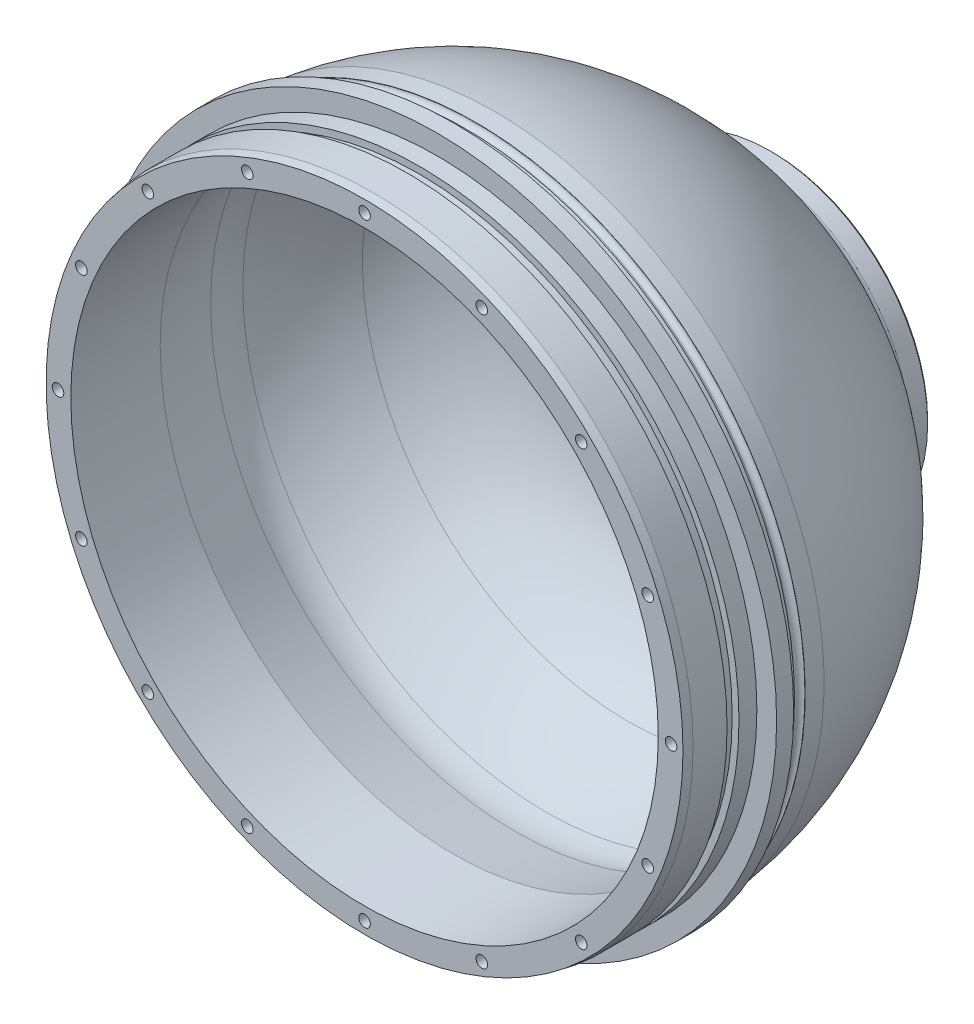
SolidWorks part; units mm, degrees
ref_plane "Front Plane" through (0, 0, 0) normal (0, 0, 1) x (1, 0, 0)
ref_plane "Top Plane" through (0, 0, 0) normal (0, 1, 0) x (1, 0, 0)
ref_plane "Right Plane" through (0, 0, 0) normal (1, 0, 0) x (0, 0, -1)
sketch "Sketch1" plane through (0, 0, 0) normal (1, 0, 0) x (0, 0, -1)
  line L0 (0, 0) -> (0, -87.63) construction
  line L1 (0, -87.63) -> (0, -101.346)
  line L2 (0, -87.63) -> (26.67, -87.63)
  line L3 (0, 0) -> (164.6305, 0) construction
  line L4 (0, -101.346) -> (26.67, -101.346)
  line L5 (26.67, -101.346) -> (26.67, -98.298)
  line L6 (26.67, -98.298) -> (38.7801, -98.298)
  line L8 (121.7669, 0) -> (121.7669, -46.99)
  line L9 (121.7669, 0) -> (101.4469, 0)
  line L10 (26.67, -87.63) -> (49.53, -91.9045)
  line L11 (101.4469, 0) -> (101.4469, -57.9788)
  line L12 (121.7669, -46.99) -> (113.7225, -46.99)
  arc A1 (49.53, -91.9045) -> (101.4469, -57.9788) centre (26.5169, 0) ccw
  arc A2 (38.7801, -98.298) -> (113.7225, -46.99) centre (26.5169, 0) ccw
  dimension "D6" = 99.06
  dimension "D7" = 94.742
  dimension "D1" = 87.63
  dimension "D2" = 101.346
  dimension "D3" = 26.67
  dimension "D4" = 26.67
  dimension "D5" = 3.048
  dimension "D8" = 46.99
  dimension "D9" = 20.32
  dimension "D10" = 22.86
  dimension "D11" = 12.1101
  dimension "D12" = 95.0969
revolve "hemi" add sketch "Sketch1" angle 360 about L3
sketch "Sketch2" plane through (0, 0, 0) normal (0, 0, 1) x (1, 0, 0)
  circle A0 centre (0, 0) radius 95.4532
  dimension "D1" = 190.9064
extrude "oring_plug" cut sketch "Sketch2" against normal blind 21.59 flip side to cut
ref_plane "oring_plane" through (0, 0, -12.7) normal (0, 0, 1) x (1, 0, 0)
sketch "Sketch3" plane through (0, 0, -12.7) normal (0, 0, 1) x (1, 0, 0)
  circle A0 centre (0, 0) radius 93.4212
  dimension "D1" = 186.8424
extrude "oring_groove" cut sketch "Sketch3" against normal blind 3.556 flip side to cut
chamfer "lead_in_chamfer" distance 2.54 distance2 0.4572 1 edges at (95.4532, 0, 0)
fillet "inside_blkhd_fillet" radius 50.8 1 edges at (57.9788, 0, -101.4469)
fillet "inside_flange_fillet" radius 19.05 1 edges at (91.9045, 0, -49.53)
ref_plane "ortman_plane" through (0, 0, -29.972) normal (0, 0, -1) x (-1, 0, 0)
sketch "Sketch4" plane through (0, 0, -29.972) normal (0, 0, -1) x (-1, 0, 0)
  circle A0 centre (0, 0) radius 96.647
  dimension "D1" = 193.294
extrude "ortman_groove" cut sketch "Sketch4" along normal blind 3.175 flip side to cut
fillet "ortman_fillet" radius 1.5875 2 edges at (-96.647, 0, -29.972) (-96.647, 0, -33.147)
sketch "Sketch5" plane through (0, 0, 0) normal (0, 0, 1) x (1, 0, 0)
  circle A0 centre (0, 0) radius 91.44 construction
  circle A1 centre (0, 91.44) radius 1.7272
  circle A2 centre (34.9926, 84.4795) radius 1.7272
  circle A3 centre (64.6578, 64.6578) radius 1.7272
  circle A4 centre (84.4795, 34.9926) radius 1.7272
  circle A5 centre (91.44, 0) radius 1.7272
  circle A6 centre (84.4795, -34.9926) radius 1.7272
  circle A7 centre (64.6578, -64.6578) radius 1.7272
  circle A8 centre (34.9926, -84.4795) radius 1.7272
  circle A9 centre (0, -91.44) radius 1.7272
  circle A10 centre (-34.9926, -84.4795) radius 1.7272
  circle A11 centre (-64.6578, -64.6578) radius 1.7272
  circle A12 centre (-84.4795, -34.9926) radius 1.7272
  circle A13 centre (-91.44, 0) radius 1.7272
  circle A14 centre (-84.4795, 34.9926) radius 1.7272
  circle A15 centre (-64.6578, 64.6578) radius 1.7272
  circle A16 centre (-34.9926, 84.4795) radius 1.7272
  dimension "D1" = 182.88
  dimension "D2" = 3.4544
extrude "male_bolt_circle_holes" cut sketch "Sketch5" against normal blind 7.62
sketch "blkhd_holes" plane through (0, 0, -121.7669) normal (0, 0, -1) x (-1, 0, 0)
  line L0 (0, 0) -> (0, 29.2621) construction
  line L1 (0, 0) -> (29.21, 0) construction
  circle A0 centre (0, 0) radius 4.953
  circle A1 centre (0, 0) radius 10.16 construction
  circle A2 centre (29.21, 15.24) radius 2.7051
  circle A3 centre (29.21, 15.24) radius 7.9375 construction
  circle A4 centre (-12.7, 30.1625) radius 7.9375 construction
  circle A5 centre (-12.7, 30.1625) radius 2.7051
  circle A6 centre (29.21, -3.81) radius 2.7051
  circle A7 centre (29.21, -3.81) radius 7.9375 construction
  circle A8 centre (-25.4, 15.875) radius 3.4544
  circle A9 centre (-25.4, 15.875) radius 9.525 construction
  circle A10 centre (-15.875, -25.4) radius 5.7531
  circle A11 centre (-15.875, -25.4) radius 13.335 construction
  circle A12 centre (12.7, 27.94) radius 11.43 construction
  circle A13 centre (12.7, 27.94) radius 5.7531
  circle A14 centre (17.78, -26.67) radius 14.224 construction
  circle A15 centre (17.78, -26.67) radius 8.763
  dimension "D1" = 9.906
  dimension "D2" = 20.32
  dimension "D3" = 5.4102
  dimension "D6" = 15.875
  dimension "D7" = 6.9088
  dimension "D10" = 19.05
  dimension "D11" = 26.67
  dimension "D12" = 11.5062
  dimension "D15" = 11.5062
  dimension "D17" = 12.7
  dimension "D18" = 22.86
  dimension "D19" = 17.526
  dimension "D20" = 28.448
  dimension "D21" = 3.81
  dimension "D23" = 5.4102
  dimension "D24" = 15.875
  dimension "D25" = 26.67
  dimension "D4" = 15.24
  dimension "D5" = 29.21
  dimension "D8" = 30.1625
  dimension "D9" = 12.7
  dimension "D13" = 25.4
  dimension "D14" = 15.875
  dimension "D16" = 27.94
  dimension "D22" = 29.21
  dimension "D26" = 17.78
  dimension "D27" = 15.875
  dimension "D28" = 25.4
fillet "aft_land_fillet" radius 3.175 1 edges at (46.99, 0, -113.7225)
chamfer "Chamfer2" distance 0.762 angle 45 1 edges at (46.99, 0, -121.7669)
extrude "blkhd_thru_holes" cut sketch "blkhd_holes" against normal through all
sketch "Sketch7" plane through (0, 0, -121.7669) normal (0, 0, -1) x (-1, 0, 0)
  circle A0 centre (-27.94, -4.7625) radius 6.35
  dimension "D1" = 12.7
  dimension "D2" = 27.94
  dimension "D3" = 4.7625
sketch "Sketch8" plane through (0, 0, -121.7669) normal (0, 0, -1) x (-1, 0, 0)
  circle A0 centre (12.7, 27.94) radius 11.43
  circle A1 centre (29.21, 15.24) radius 7.9375
  circle A2 centre (29.21, -3.81) radius 7.9375
  circle A3 centre (-15.875, -25.4) radius 13.335
  circle A4 centre (-25.4, 15.875) radius 9.525
  circle A5 centre (-12.7, 30.1625) radius 7.9375
  circle A6 centre (0, 0) radius 10.16
  circle A7 centre (17.78, -26.67) radius 14.224
  dimension "D1" = 22.86
  dimension "D2" = 15.875
  dimension "D3" = 19.05
  dimension "D4" = 26.67
  dimension "D5" = 15.875
  dimension "D6" = 15.875
  dimension "D7" = 20.32
  dimension "D8" = 28.448
extrude "lands" cut sketch "Sketch8" against normal blind 0.0762
extrude "press_relief_hole" cut sketch "Sketch7" against normal through all
sketch "Sketch9" plane through (0, 0, -121.7669) normal (0, 0, -1) x (-1, 0, 0)
  circle A0 centre (-27.94, -4.7625) radius 9.5504
  dimension "D1" = 19.1008
extrude "press_relief_cbore" cut sketch "Sketch9" against normal blind 5.08
sketch "Sketch10" plane through (0, 0, -101.4469) normal (0, 0, 1) x (1, 0, 0)
  circle A0 centre (0, 0) radius 9.525
  circle A1 centre (25.4, 15.875) radius 9.525
  dimension "D1" = 19.05
  dimension "D2" = 19.05
extrude "Cut-Extrude1" cut sketch "Sketch10" against normal blind 0.254
chamfer "pr_relief_chamfer" distance 0.762 angle 30 1 edges at (18.3896, -4.7625, -121.7669)
chamfer "Chamfer3" distance 0.508 angle 30 1 edges at (34.29, -4.7625, -101.4469)
sketch "Sketch12" plane through (0, 0, 0) normal (0, 0, 1) x (1, 0, 0)
  line L0 (-91.44, 0) -> (91.44, 0) construction
sketch "Sketch13" plane through (0, 0, -101.4469) normal (0, 0, 1) x (1, 0, 0)
  circle A0 centre (-17.78, -26.67) radius 2.7439
